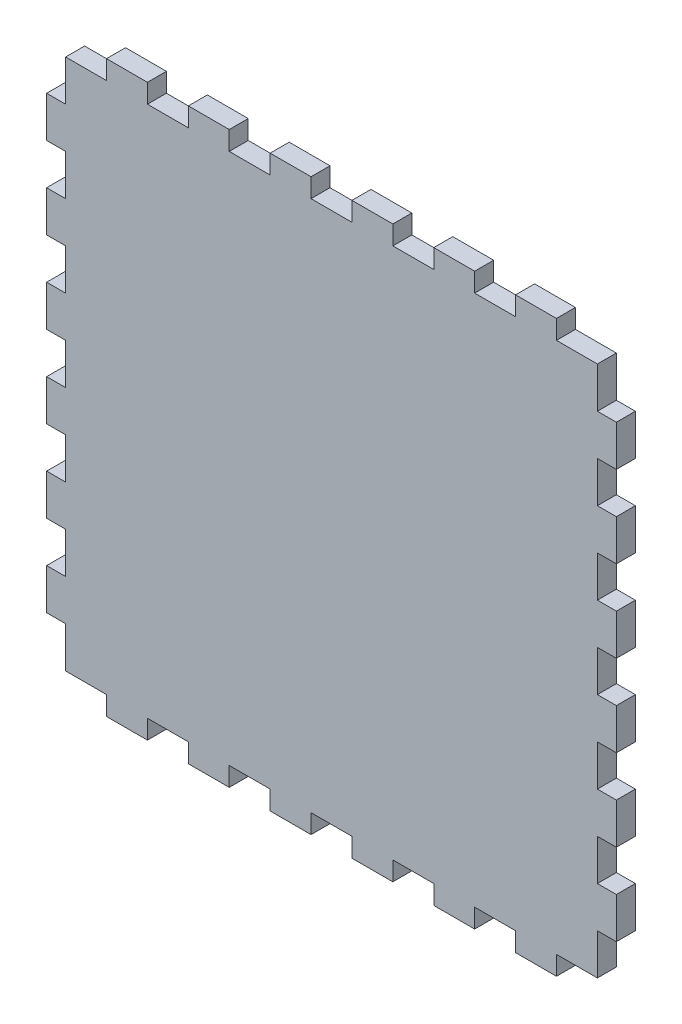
SolidWorks part; units mm, degrees
ref_plane "Front Plane" through (0, 0, 0) normal (0, 0, 1) x (1, 0, 0)
ref_plane "Top Plane" through (0, 0, 0) normal (0, 1, 0) x (1, 0, 0)
ref_plane "Right Plane" through (0, 0, 0) normal (1, 0, 0) x (0, 0, -1)
sketch "Model" plane through (0, 0, 0) normal (0, 0, 1) x (1, 0, 0)
  line L0 (83, 83) -> (87, 83)
  line L1 (87, 83) -> (87, 79)
  line L2 (87, 79) -> (95, 79)
  line L3 (95, 79) -> (95, 83)
  line L4 (95, 83) -> (103, 83)
  line L5 (103, 83) -> (103, 79)
  line L6 (103, 79) -> (111, 79)
  line L7 (111, 79) -> (111, 83)
  line L8 (111, 83) -> (119, 83)
  line L9 (119, 83) -> (119, 79)
  line L10 (119, 79) -> (127, 79)
  line L11 (127, 79) -> (127, 83)
  line L12 (127, 83) -> (135, 83)
  line L13 (135, 83) -> (135, 79)
  line L14 (135, 79) -> (143, 79)
  line L15 (143, 79) -> (143, 83)
  line L16 (143, 83) -> (151, 83)
  line L17 (151, 83) -> (151, 79)
  line L18 (151, 79) -> (159, 79)
  line L19 (159, 79) -> (159, 83)
  line L20 (159, 83) -> (167, 83)
  line L21 (167, 83) -> (167, 79)
  line L22 (167, 79) -> (175, 79)
  line L23 (175, 79) -> (175, 83)
  line L24 (175, 83) -> (183, 83)
  line L25 (183, 83) -> (183, 79)
  line L26 (183, 79) -> (191, 79)
  line L27 (191, 79) -> (191, 83)
  line L28 (191, 83) -> (195, 83)
  line L29 (195, 83) -> (195, 91.61)
  line L30 (195, 91.61) -> (199, 91.61)
  line L31 (199, 91.61) -> (199, 100.23)
  line L32 (199, 100.23) -> (195, 100.23)
  line L33 (195, 100.23) -> (195, 108.85)
  line L34 (195, 108.85) -> (199, 108.85)
  line L35 (199, 108.85) -> (199, 117.46)
  line L36 (199, 117.46) -> (195, 117.46)
  line L37 (195, 117.46) -> (195, 126.08)
  line L38 (195, 126.08) -> (199, 126.08)
  line L39 (199, 126.08) -> (199, 134.69)
  line L40 (199, 134.69) -> (195, 134.69)
  line L41 (195, 134.69) -> (195, 143.31)
  line L42 (195, 143.31) -> (199, 143.31)
  line L43 (199, 143.31) -> (199, 151.92)
  line L44 (199, 151.92) -> (195, 151.92)
  line L45 (195, 151.92) -> (195, 160.54)
  line L46 (195, 160.54) -> (199, 160.54)
  line L47 (199, 160.54) -> (199, 169.15)
  line L48 (199, 169.15) -> (195, 169.15)
  line L49 (195, 169.15) -> (195, 177.77)
  line L50 (195, 177.77) -> (199, 177.77)
  line L51 (199, 177.77) -> (199, 186.38)
  line L52 (199, 186.38) -> (195, 186.38)
  line L53 (195, 186.38) -> (195, 195)
  line L54 (195, 195) -> (191, 195)
  line L55 (191, 195) -> (191, 199)
  line L56 (191, 199) -> (183, 199)
  line L57 (183, 199) -> (183, 195)
  line L58 (183, 195) -> (175, 195)
  line L59 (175, 195) -> (175, 199)
  line L60 (175, 199) -> (167, 199)
  line L61 (167, 199) -> (167, 195)
  line L62 (167, 195) -> (159, 195)
  line L63 (159, 195) -> (159, 199)
  line L64 (159, 199) -> (151, 199)
  line L65 (151, 199) -> (151, 195)
  line L66 (151, 195) -> (143, 195)
  line L67 (143, 195) -> (143, 199)
  line L68 (143, 199) -> (135, 199)
  line L69 (135, 199) -> (135, 195)
  line L70 (135, 195) -> (127, 195)
  line L71 (127, 195) -> (127, 199)
  line L72 (127, 199) -> (119, 199)
  line L73 (119, 199) -> (119, 195)
  line L74 (119, 195) -> (111, 195)
  line L75 (111, 195) -> (111, 199)
  line L76 (111, 199) -> (103, 199)
  line L77 (103, 199) -> (103, 195)
  line L78 (103, 195) -> (95, 195)
  line L79 (95, 195) -> (95, 199)
  line L80 (95, 199) -> (87, 199)
  line L81 (87, 199) -> (87, 195)
  line L82 (87, 195) -> (83, 195)
  line L83 (83, 195) -> (83, 186.38)
  line L84 (83, 186.38) -> (79, 186.38)
  line L85 (79, 186.38) -> (79, 177.77)
  line L86 (79, 177.77) -> (83, 177.77)
  line L87 (83, 177.77) -> (83, 169.15)
  line L88 (83, 169.15) -> (79, 169.15)
  line L89 (79, 169.15) -> (79, 160.54)
  line L90 (79, 160.54) -> (83, 160.54)
  line L91 (83, 160.54) -> (83, 151.92)
  line L92 (83, 151.92) -> (79, 151.92)
  line L93 (79, 151.92) -> (79, 143.31)
  line L94 (79, 143.31) -> (83, 143.31)
  line L95 (83, 143.31) -> (83, 134.69)
  line L96 (83, 134.69) -> (79, 134.69)
  line L97 (79, 134.69) -> (79, 126.08)
  line L98 (79, 126.08) -> (83, 126.08)
  line L99 (83, 126.08) -> (83, 117.46)
  line L100 (83, 117.46) -> (79, 117.46)
  line L101 (79, 117.46) -> (79, 108.85)
  line L102 (79, 108.85) -> (83, 108.85)
  line L103 (83, 108.85) -> (83, 100.23)
  line L104 (83, 100.23) -> (79, 100.23)
  line L105 (79, 100.23) -> (79, 91.61)
  line L106 (79, 91.61) -> (83, 91.61)
  line L107 (83, 91.61) -> (83, 83)
  line L108 (83, 0) -> (91.61, 0)
  line L109 (91.61, 0) -> (91.61, 4)
  line L110 (91.61, 4) -> (100.23, 4)
  line L111 (100.23, 4) -> (100.23, 0)
  line L112 (100.23, 0) -> (108.85, 0)
  line L113 (108.85, 0) -> (108.85, 4)
  line L114 (108.85, 4) -> (117.46, 4)
  line L115 (117.46, 4) -> (117.46, 0)
  line L116 (117.46, 0) -> (126.08, 0)
  line L117 (126.08, 0) -> (126.08, 4)
  line L118 (126.08, 4) -> (134.69, 4)
  line L119 (134.69, 4) -> (134.69, 0)
  line L120 (134.69, 0) -> (143.31, 0)
  line L121 (143.31, 0) -> (143.31, 4)
  line L122 (143.31, 4) -> (151.92, 4)
  line L123 (151.92, 4) -> (151.92, 0)
  line L124 (151.92, 0) -> (160.54, 0)
  line L125 (160.54, 0) -> (160.54, 4)
  line L126 (160.54, 4) -> (169.15, 4)
  line L127 (169.15, 4) -> (169.15, 0)
  line L128 (169.15, 0) -> (177.77, 0)
  line L129 (177.77, 0) -> (177.77, 4)
  line L130 (177.77, 4) -> (186.38, 4)
  line L131 (186.38, 4) -> (186.38, 0)
  line L132 (186.38, 0) -> (195, 0)
  line L133 (195, 0) -> (199, 0)
  line L134 (199, 0) -> (199, 8.33)
  line L135 (199, 8.33) -> (195, 8.33)
  line L136 (195, 8.33) -> (195, 16.67)
  line L137 (195, 16.67) -> (199, 16.67)
  line L138 (199, 16.67) -> (199, 25)
  line L139 (199, 25) -> (195, 25)
  line L140 (195, 25) -> (195, 33.33)
  line L141 (195, 33.33) -> (199, 33.33)
  line L142 (199, 33.33) -> (199, 41.67)
  line L143 (199, 41.67) -> (195, 41.67)
  line L144 (195, 41.67) -> (195, 50)
  line L145 (195, 50) -> (199, 50)
  line L146 (199, 50) -> (199, 58.33)
  line L147 (199, 58.33) -> (195, 58.33)
  line L148 (195, 58.33) -> (195, 66.67)
  line L149 (195, 66.67) -> (199, 66.67)
  line L150 (199, 66.67) -> (199, 75)
  line L151 (199, 75) -> (191, 75)
  line L152 (191, 75) -> (191, 71)
  line L153 (191, 71) -> (183, 71)
  line L154 (183, 71) -> (183, 75)
  line L155 (183, 75) -> (175, 75)
  line L156 (175, 75) -> (175, 71)
  line L157 (175, 71) -> (167, 71)
  line L158 (167, 71) -> (167, 75)
  line L159 (167, 75) -> (159, 75)
  line L160 (159, 75) -> (159, 71)
  line L161 (159, 71) -> (151, 71)
  line L162 (151, 71) -> (151, 75)
  line L163 (151, 75) -> (143, 75)
  line L164 (143, 75) -> (143, 71)
  line L165 (143, 71) -> (135, 71)
  line L166 (135, 71) -> (135, 75)
  line L167 (135, 75) -> (127, 75)
  line L168 (127, 75) -> (127, 71)
  line L169 (127, 71) -> (119, 71)
  line L170 (119, 71) -> (119, 75)
  line L171 (119, 75) -> (111, 75)
  line L172 (111, 75) -> (111, 71)
  line L173 (111, 71) -> (103, 71)
  line L174 (103, 71) -> (103, 75)
  line L175 (103, 75) -> (95, 75)
  line L176 (95, 75) -> (95, 71)
  line L177 (95, 71) -> (87, 71)
  line L178 (87, 71) -> (87, 75)
  line L179 (87, 75) -> (79, 75)
  line L180 (79, 75) -> (79, 66.67)
  line L181 (79, 66.67) -> (83, 66.67)
  line L182 (83, 66.67) -> (83, 58.33)
  line L183 (83, 58.33) -> (79, 58.33)
  line L184 (79, 58.33) -> (79, 50)
  line L185 (79, 50) -> (83, 50)
  line L186 (83, 50) -> (83, 41.67)
  line L187 (83, 41.67) -> (79, 41.67)
  line L188 (79, 41.67) -> (79, 33.33)
  line L189 (79, 33.33) -> (83, 33.33)
  line L190 (83, 33.33) -> (83, 25)
  line L191 (83, 25) -> (79, 25)
  line L192 (79, 25) -> (79, 16.67)
  line L193 (79, 16.67) -> (83, 16.67)
  line L194 (83, 16.67) -> (83, 8.33)
  line L195 (83, 8.33) -> (79, 8.33)
  line L196 (79, 8.33) -> (79, 0)
  line L197 (79, 0) -> (83, 0)
  line L198 (83, 278) -> (91.61, 278)
  line L199 (91.61, 278) -> (91.61, 274)
  line L200 (91.61, 274) -> (100.23, 274)
  line L201 (100.23, 274) -> (100.23, 278)
  line L202 (100.23, 278) -> (108.85, 278)
  line L203 (108.85, 278) -> (108.85, 274)
  line L204 (108.85, 274) -> (117.46, 274)
  line L205 (117.46, 274) -> (117.46, 278)
  line L206 (117.46, 278) -> (126.08, 278)
  line L207 (126.08, 278) -> (126.08, 274)
  line L208 (126.08, 274) -> (134.69, 274)
  line L209 (134.69, 274) -> (134.69, 278)
  line L210 (134.69, 278) -> (143.31, 278)
  line L211 (143.31, 278) -> (143.31, 274)
  line L212 (143.31, 274) -> (151.92, 274)
  line L213 (151.92, 274) -> (151.92, 278)
  line L214 (151.92, 278) -> (160.54, 278)
  line L215 (160.54, 278) -> (160.54, 274)
  line L216 (160.54, 274) -> (169.15, 274)
  line L217 (169.15, 274) -> (169.15, 278)
  line L218 (169.15, 278) -> (177.77, 278)
  line L219 (177.77, 278) -> (177.77, 274)
  line L220 (177.77, 274) -> (186.38, 274)
  line L221 (186.38, 274) -> (186.38, 278)
  line L222 (186.38, 278) -> (195, 278)
  line L223 (195, 278) -> (199, 278)
  line L224 (199, 278) -> (199, 269.67)
  line L225 (199, 269.67) -> (195, 269.67)
  line L226 (195, 269.67) -> (195, 261.33)
  line L227 (195, 261.33) -> (199, 261.33)
  line L228 (199, 261.33) -> (199, 253)
  line L229 (199, 253) -> (195, 253)
  line L230 (195, 253) -> (195, 244.67)
  line L231 (195, 244.67) -> (199, 244.67)
  line L232 (199, 244.67) -> (199, 236.33)
  line L233 (199, 236.33) -> (195, 236.33)
  line L234 (195, 236.33) -> (195, 228)
  line L235 (195, 228) -> (199, 228)
  line L236 (199, 228) -> (199, 219.67)
  line L237 (199, 219.67) -> (195, 219.67)
  line L238 (195, 219.67) -> (195, 211.33)
  line L239 (195, 211.33) -> (199, 211.33)
  line L240 (199, 211.33) -> (199, 203)
  line L241 (199, 203) -> (191, 203)
  line L242 (191, 203) -> (191, 207)
  line L243 (191, 207) -> (183, 207)
  line L244 (183, 207) -> (183, 203)
  line L245 (183, 203) -> (175, 203)
  line L246 (175, 203) -> (175, 207)
  line L247 (175, 207) -> (167, 207)
  line L248 (167, 207) -> (167, 203)
  line L249 (167, 203) -> (159, 203)
  line L250 (159, 203) -> (159, 207)
  line L251 (159, 207) -> (151, 207)
  line L252 (151, 207) -> (151, 203)
  line L253 (151, 203) -> (143, 203)
  line L254 (143, 203) -> (143, 207)
  line L255 (143, 207) -> (135, 207)
  line L256 (135, 207) -> (135, 203)
  line L257 (135, 203) -> (127, 203)
  line L258 (127, 203) -> (127, 207)
  line L259 (127, 207) -> (119, 207)
  line L260 (119, 207) -> (119, 203)
  line L261 (119, 203) -> (111, 203)
  line L262 (111, 203) -> (111, 207)
  line L263 (111, 207) -> (103, 207)
  line L264 (103, 207) -> (103, 203)
  line L265 (103, 203) -> (95, 203)
  line L266 (95, 203) -> (95, 207)
  line L267 (95, 207) -> (87, 207)
  line L268 (87, 207) -> (87, 203)
  line L269 (87, 203) -> (79, 203)
  line L270 (79, 203) -> (79, 211.33)
  line L271 (79, 211.33) -> (83, 211.33)
  line L272 (83, 211.33) -> (83, 219.67)
  line L273 (83, 219.67) -> (79, 219.67)
  line L274 (79, 219.67) -> (79, 228)
  line L275 (79, 228) -> (83, 228)
  line L276 (83, 228) -> (83, 236.33)
  line L277 (83, 236.33) -> (79, 236.33)
  line L278 (79, 236.33) -> (79, 244.67)
  line L279 (79, 244.67) -> (83, 244.67)
  line L280 (83, 244.67) -> (83, 253)
  line L281 (83, 253) -> (79, 253)
  line L282 (79, 253) -> (79, 261.33)
  line L283 (79, 261.33) -> (83, 261.33)
  line L284 (83, 261.33) -> (83, 269.67)
  line L285 (83, 269.67) -> (79, 269.67)
  line L286 (79, 269.67) -> (79, 278)
  line L287 (79, 278) -> (83, 278)
  line L288 (0, 83) -> (0, 91.61)
  line L289 (0, 91.61) -> (4, 91.61)
  line L290 (4, 91.61) -> (4, 100.23)
  line L291 (4, 100.23) -> (0, 100.23)
  line L292 (0, 100.23) -> (0, 108.85)
  line L293 (0, 108.85) -> (4, 108.85)
  line L294 (4, 108.85) -> (4, 117.46)
  line L295 (4, 117.46) -> (0, 117.46)
  line L296 (0, 117.46) -> (0, 126.08)
  line L297 (0, 126.08) -> (4, 126.08)
  line L298 (4, 126.08) -> (4, 134.69)
  line L299 (4, 134.69) -> (0, 134.69)
  line L300 (0, 134.69) -> (0, 143.31)
  line L301 (0, 143.31) -> (4, 143.31)
  line L302 (4, 143.31) -> (4, 151.92)
  line L303 (4, 151.92) -> (0, 151.92)
  line L304 (0, 151.92) -> (0, 160.54)
  line L305 (0, 160.54) -> (4, 160.54)
  line L306 (4, 160.54) -> (4, 169.15)
  line L307 (4, 169.15) -> (0, 169.15)
  line L308 (0, 169.15) -> (0, 177.77)
  line L309 (0, 177.77) -> (4, 177.77)
  line L310 (4, 177.77) -> (4, 186.38)
  line L311 (4, 186.38) -> (0, 186.38)
  line L312 (0, 186.38) -> (0, 195)
  line L313 (0, 195) -> (8.33, 195)
  line L314 (8.33, 195) -> (8.33, 199)
  line L315 (8.33, 199) -> (16.67, 199)
  line L316 (16.67, 199) -> (16.67, 195)
  line L317 (16.67, 195) -> (25, 195)
  line L318 (25, 195) -> (25, 199)
  line L319 (25, 199) -> (33.33, 199)
  line L320 (33.33, 199) -> (33.33, 195)
  line L321 (33.33, 195) -> (41.67, 195)
  line L322 (41.67, 195) -> (41.67, 199)
  line L323 (41.67, 199) -> (50, 199)
  line L324 (50, 199) -> (50, 195)
  line L325 (50, 195) -> (58.33, 195)
  line L326 (58.33, 195) -> (58.33, 199)
  line L327 (58.33, 199) -> (66.67, 199)
  line L328 (66.67, 199) -> (66.67, 195)
  line L329 (66.67, 195) -> (75, 195)
  line L330 (75, 195) -> (75, 186.38)
  line L331 (75, 186.38) -> (71, 186.38)
  line L332 (71, 186.38) -> (71, 177.77)
  line L333 (71, 177.77) -> (75, 177.77)
  line L334 (75, 177.77) -> (75, 169.15)
  line L335 (75, 169.15) -> (71, 169.15)
  line L336 (71, 169.15) -> (71, 160.54)
  line L337 (71, 160.54) -> (75, 160.54)
  line L338 (75, 160.54) -> (75, 151.92)
  line L339 (75, 151.92) -> (71, 151.92)
  line L340 (71, 151.92) -> (71, 143.31)
  line L341 (71, 143.31) -> (75, 143.31)
  line L342 (75, 143.31) -> (75, 134.69)
  line L343 (75, 134.69) -> (71, 134.69)
  line L344 (71, 134.69) -> (71, 126.08)
  line L345 (71, 126.08) -> (75, 126.08)
  line L346 (75, 126.08) -> (75, 117.46)
  line L347 (75, 117.46) -> (71, 117.46)
  line L348 (71, 117.46) -> (71, 108.85)
  line L349 (71, 108.85) -> (75, 108.85)
  line L350 (75, 108.85) -> (75, 100.23)
  line L351 (75, 100.23) -> (71, 100.23)
  line L352 (71, 100.23) -> (71, 91.61)
  line L353 (71, 91.61) -> (75, 91.61)
  line L354 (75, 91.61) -> (75, 83)
  line L355 (75, 83) -> (66.67, 83)
  line L356 (66.67, 83) -> (66.67, 79)
  line L357 (66.67, 79) -> (58.33, 79)
  line L358 (58.33, 79) -> (58.33, 83)
  line L359 (58.33, 83) -> (50, 83)
  line L360 (50, 83) -> (50, 79)
  line L361 (50, 79) -> (41.67, 79)
  line L362 (41.67, 79) -> (41.67, 83)
  line L363 (41.67, 83) -> (33.33, 83)
  line L364 (33.33, 83) -> (33.33, 79)
  line L365 (33.33, 79) -> (25, 79)
  line L366 (25, 79) -> (25, 83)
  line L367 (25, 83) -> (16.67, 83)
  line L368 (16.67, 83) -> (16.67, 79)
  line L369 (16.67, 79) -> (8.33, 79)
  line L370 (8.33, 79) -> (8.33, 83)
  line L371 (8.33, 83) -> (0, 83)
  line L372 (278, 83) -> (278, 91.61)
  line L373 (278, 91.61) -> (274, 91.61)
  line L374 (274, 91.61) -> (274, 100.23)
  line L375 (274, 100.23) -> (278, 100.23)
  line L376 (278, 100.23) -> (278, 108.85)
  line L377 (278, 108.85) -> (274, 108.85)
  line L378 (274, 108.85) -> (274, 117.46)
  line L379 (274, 117.46) -> (278, 117.46)
  line L380 (278, 117.46) -> (278, 126.08)
  line L381 (278, 126.08) -> (274, 126.08)
  line L382 (274, 126.08) -> (274, 134.69)
  line L383 (274, 134.69) -> (278, 134.69)
  line L384 (278, 134.69) -> (278, 143.31)
  line L385 (278, 143.31) -> (274, 143.31)
  line L386 (274, 143.31) -> (274, 151.92)
  line L387 (274, 151.92) -> (278, 151.92)
  line L388 (278, 151.92) -> (278, 160.54)
  line L389 (278, 160.54) -> (274, 160.54)
  line L390 (274, 160.54) -> (274, 169.15)
  line L391 (274, 169.15) -> (278, 169.15)
  line L392 (278, 169.15) -> (278, 177.77)
  line L393 (278, 177.77) -> (274, 177.77)
  line L394 (274, 177.77) -> (274, 186.38)
  line L395 (274, 186.38) -> (278, 186.38)
  line L396 (278, 186.38) -> (278, 195)
  line L397 (278, 195) -> (269.67, 195)
  line L398 (269.67, 195) -> (269.67, 199)
  line L399 (269.67, 199) -> (261.33, 199)
  line L400 (261.33, 199) -> (261.33, 195)
  line L401 (261.33, 195) -> (253, 195)
  line L402 (253, 195) -> (253, 199)
  line L403 (253, 199) -> (244.67, 199)
  line L404 (244.67, 199) -> (244.67, 195)
  line L405 (244.67, 195) -> (236.33, 195)
  line L406 (236.33, 195) -> (236.33, 199)
  line L407 (236.33, 199) -> (228, 199)
  line L408 (228, 199) -> (228, 195)
  line L409 (228, 195) -> (219.67, 195)
  line L410 (219.67, 195) -> (219.67, 199)
  line L411 (219.67, 199) -> (211.33, 199)
  line L412 (211.33, 199) -> (211.33, 195)
  line L413 (211.33, 195) -> (203, 195)
  line L414 (203, 195) -> (203, 186.38)
  line L415 (203, 186.38) -> (207, 186.38)
  line L416 (207, 186.38) -> (207, 177.77)
  line L417 (207, 177.77) -> (203, 177.77)
  line L418 (203, 177.77) -> (203, 169.15)
  line L419 (203, 169.15) -> (207, 169.15)
  line L420 (207, 169.15) -> (207, 160.54)
  line L421 (207, 160.54) -> (203, 160.54)
  line L422 (203, 160.54) -> (203, 151.92)
  line L423 (203, 151.92) -> (207, 151.92)
  line L424 (207, 151.92) -> (207, 143.31)
  line L425 (207, 143.31) -> (203, 143.31)
  line L426 (203, 143.31) -> (203, 134.69)
  line L427 (203, 134.69) -> (207, 134.69)
  line L428 (207, 134.69) -> (207, 126.08)
  line L429 (207, 126.08) -> (203, 126.08)
  line L430 (203, 126.08) -> (203, 117.46)
  line L431 (203, 117.46) -> (207, 117.46)
  line L432 (207, 117.46) -> (207, 108.85)
  line L433 (207, 108.85) -> (203, 108.85)
  line L434 (203, 108.85) -> (203, 100.23)
  line L435 (203, 100.23) -> (207, 100.23)
  line L436 (207, 100.23) -> (207, 91.61)
  line L437 (207, 91.61) -> (203, 91.61)
  line L438 (203, 91.61) -> (203, 83)
  line L439 (203, 83) -> (211.33, 83)
  line L440 (211.33, 83) -> (211.33, 79)
  line L441 (211.33, 79) -> (219.67, 79)
  line L442 (219.67, 79) -> (219.67, 83)
  line L443 (219.67, 83) -> (228, 83)
  line L444 (228, 83) -> (228, 79)
  line L445 (228, 79) -> (236.33, 79)
  line L446 (236.33, 79) -> (236.33, 83)
  line L447 (236.33, 83) -> (244.67, 83)
  line L448 (244.67, 83) -> (244.67, 79)
  line L449 (244.67, 79) -> (253, 79)
  line L450 (253, 79) -> (253, 83)
  line L451 (253, 83) -> (261.33, 83)
  line L452 (261.33, 83) -> (261.33, 79)
  line L453 (261.33, 79) -> (269.67, 79)
  line L454 (269.67, 79) -> (269.67, 83)
  line L455 (269.67, 83) -> (278, 83)
  line L456 (83, 286) -> (91.61, 286)
  line L457 (91.61, 286) -> (91.61, 282)
  line L458 (91.61, 282) -> (100.23, 282)
  line L459 (100.23, 282) -> (100.23, 286)
  line L460 (100.23, 286) -> (108.85, 286)
  line L461 (108.85, 286) -> (108.85, 282)
  line L462 (108.85, 282) -> (117.46, 282)
  line L463 (117.46, 282) -> (117.46, 286)
  line L464 (117.46, 286) -> (126.08, 286)
  line L465 (126.08, 286) -> (126.08, 282)
  line L466 (126.08, 282) -> (134.69, 282)
  line L467 (134.69, 282) -> (134.69, 286)
  line L468 (134.69, 286) -> (143.31, 286)
  line L469 (143.31, 286) -> (143.31, 282)
  line L470 (143.31, 282) -> (151.92, 282)
  line L471 (151.92, 282) -> (151.92, 286)
  line L472 (151.92, 286) -> (160.54, 286)
  line L473 (160.54, 286) -> (160.54, 282)
  line L474 (160.54, 282) -> (169.15, 282)
  line L475 (169.15, 282) -> (169.15, 286)
  line L476 (169.15, 286) -> (177.77, 286)
  line L477 (177.77, 286) -> (177.77, 282)
  line L478 (177.77, 282) -> (186.38, 282)
  line L479 (186.38, 282) -> (186.38, 286)
  line L480 (186.38, 286) -> (195, 286)
  line L481 (195, 286) -> (195, 294.62)
  line L482 (195, 294.62) -> (199, 294.62)
  line L483 (199, 294.62) -> (199, 303.23)
  line L484 (199, 303.23) -> (195, 303.23)
  line L485 (195, 303.23) -> (195, 311.85)
  line L486 (195, 311.85) -> (199, 311.85)
  line L487 (199, 311.85) -> (199, 320.46)
  line L488 (199, 320.46) -> (195, 320.46)
  line L489 (195, 320.46) -> (195, 329.08)
  line L490 (195, 329.08) -> (199, 329.08)
  line L491 (199, 329.08) -> (199, 337.69)
  line L492 (199, 337.69) -> (195, 337.69)
  line L493 (195, 337.69) -> (195, 346.31)
  line L494 (195, 346.31) -> (199, 346.31)
  line L495 (199, 346.31) -> (199, 354.92)
  line L496 (199, 354.92) -> (195, 354.92)
  line L497 (195, 354.92) -> (195, 363.54)
  line L498 (195, 363.54) -> (199, 363.54)
  line L499 (199, 363.54) -> (199, 372.15)
  line L500 (199, 372.15) -> (195, 372.15)
  line L501 (195, 372.15) -> (195, 380.77)
  line L502 (195, 380.77) -> (199, 380.77)
  line L503 (199, 380.77) -> (199, 389.38)
  line L504 (199, 389.38) -> (195, 389.38)
  line L505 (195, 389.38) -> (195, 398)
  line L506 (195, 398) -> (186.38, 398)
  line L507 (186.38, 398) -> (186.38, 402)
  line L508 (186.38, 402) -> (177.77, 402)
  line L509 (177.77, 402) -> (177.77, 398)
  line L510 (177.77, 398) -> (169.15, 398)
  line L511 (169.15, 398) -> (169.15, 402)
  line L512 (169.15, 402) -> (160.54, 402)
  line L513 (160.54, 402) -> (160.54, 398)
  line L514 (160.54, 398) -> (151.92, 398)
  line L515 (151.92, 398) -> (151.92, 402)
  line L516 (151.92, 402) -> (143.31, 402)
  line L517 (143.31, 402) -> (143.31, 398)
  line L518 (143.31, 398) -> (134.69, 398)
  line L519 (134.69, 398) -> (134.69, 402)
  line L520 (134.69, 402) -> (126.08, 402)
  line L521 (126.08, 402) -> (126.08, 398)
  line L522 (126.08, 398) -> (117.46, 398)
  line L523 (117.46, 398) -> (117.46, 402)
  line L524 (117.46, 402) -> (108.85, 402)
  line L525 (108.85, 402) -> (108.85, 398)
  line L526 (108.85, 398) -> (100.23, 398)
  line L527 (100.23, 398) -> (100.23, 402)
  line L528 (100.23, 402) -> (91.61, 402)
  line L529 (91.61, 402) -> (91.61, 398)
  line L530 (91.61, 398) -> (83, 398)
  line L531 (83, 398) -> (83, 389.38)
  line L532 (83, 389.38) -> (79, 389.38)
  line L533 (79, 389.38) -> (79, 380.77)
  line L534 (79, 380.77) -> (83, 380.77)
  line L535 (83, 380.77) -> (83, 372.15)
  line L536 (83, 372.15) -> (79, 372.15)
  line L537 (79, 372.15) -> (79, 363.54)
  line L538 (79, 363.54) -> (83, 363.54)
  line L539 (83, 363.54) -> (83, 354.92)
  line L540 (83, 354.92) -> (79, 354.92)
  line L541 (79, 354.92) -> (79, 346.31)
  line L542 (79, 346.31) -> (83, 346.31)
  line L543 (83, 346.31) -> (83, 337.69)
  line L544 (83, 337.69) -> (79, 337.69)
  line L545 (79, 337.69) -> (79, 329.08)
  line L546 (79, 329.08) -> (83, 329.08)
  line L547 (83, 329.08) -> (83, 320.46)
  line L548 (83, 320.46) -> (79, 320.46)
  line L549 (79, 320.46) -> (79, 311.85)
  line L550 (79, 311.85) -> (83, 311.85)
  line L551 (83, 311.85) -> (83, 303.23)
  line L552 (83, 303.23) -> (79, 303.23)
  line L553 (79, 303.23) -> (79, 294.62)
  line L554 (79, 294.62) -> (83, 294.62)
  line L555 (83, 294.62) -> (83, 286)
extrude "Boss-Extrude2" add sketch "Model" along normal blind 4 contours L554 L555 L456 L457 L458 L459 L460 L461 L462 L463 L464 L465 L466 L467 L468 L469 L470 L471 L472 L473 L474 L475 L476 L477 L478 L479 L480 L481 L482 L483 L484 L485 L486 L487 L488 L489 L490 L491 L492 L493 L494 L495 L496 L497 L498 L499 L500 L501 L502 L503 L504
